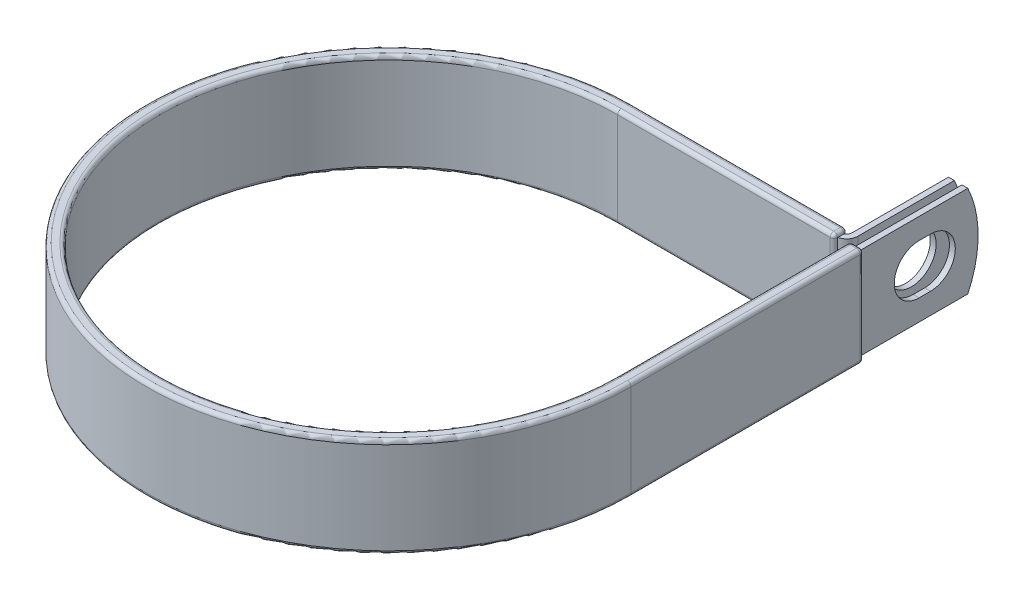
SolidWorks part; units mm, degrees
ref_plane "Front Plane" through (0, 0, 0) normal (0, 0, 1) x (1, 0, 0)
ref_plane "Top Plane" through (0, 0, 0) normal (0, 1, 0) x (1, 0, 0)
ref_plane "Right Plane" through (0, 0, 0) normal (1, 0, 0) x (0, 0, -1)
sketch "Sketch1" plane through (0, 0, 0) normal (0, 1, 0) x (1, 0, 0)
  line L0 (0, 48.4187) -> (44.4665, 48.4187)
  line L1 (48.4187, 0) -> (48.4187, 48.4187)
  line L2 (46.8439, 72.9996) -> (46.8439, 50.7962)
  line L5 (48.4187, 48.4187) -> (48.4187, 72.9996)
  arc A0 (0, 48.4187) -> (48.4187, 0) centre (0, 0) ccw
  arc A3 (44.4665, 48.4187) -> (46.8439, 50.7962) centre (44.4665, 50.7962) ccw
extrude "Extrude-Thin1" add sketch "Sketch1" along normal mid plane 19.05 thin
sketch "Sketch2" plane through (45.6247, 0, 0) normal (-1, 0, 0) x (0, 0, 1)
  line L0 (-72.9996, 9.525) -> (-72.9996, -9.525) construction
  line L7 (0, 9.525) -> (0, -9.525) construction
  circle A0 centre (-61.8998, 0) radius 5.1562
  point P2 (-72.9996, 0)
extrude "Cut-Extrude1" cut sketch "Sketch2" against normal up to surface (1.2192 mm away)
sketch "Sketch3" plane through (49.6379, 0, 0) normal (1, 0, 0) x (0, 0, -1)
  line L0 (60.706, 0) -> (63.0936, 0) construction
  line L1 (60.706, 5.1562) -> (63.0936, 5.1562)
  line L2 (60.706, -5.1562) -> (63.0936, -5.1562)
  line L3 (72.9996, 9.525) -> (72.9996, -9.525) construction
  arc A0 (60.706, 5.1562) -> (60.706, -5.1562) centre (60.706, 0) ccw
  arc A1 (63.0936, -5.1562) -> (63.0936, 5.1562) centre (63.0936, 0) ccw
  point P3 (61.8998, 0)
  point P8 (72.9996, 0)
  point P11 (55.5498, 0)
  point P12 (68.2498, 0)
extrude "Cut-Extrude2" cut sketch "Sketch3" against normal up to surface (1.2192 mm away)
sketch "Sketch4" plane through (45.6247, 0, 0) normal (-1, 0, 0) x (0, 0, 1)
  line L0 (-72.9996, 9.525) -> (-72.9996, -9.525)
  line L1 (-72.9996, 9.525) -> (-70.8551, 9.525)
  line L2 (-72.9996, 9.525) -> (-50.7962, 9.525) construction
  line L3 (-72.9996, -9.525) -> (-70.8551, -9.525)
  line L4 (-72.9996, -9.525) -> (-50.7962, -9.525) construction
  arc A0 (-70.8551, 9.525) -> (-70.8551, -9.525) centre (-50.7746, 0) ccw
extrude "Cut-Extrude3" cut sketch "Sketch4" against normal through all contours A0 M4 M5 | A0 L0 M2
ref_plane "Plane1" through (0, 0, -48.4187) normal (0, 0, 1) x (1, 0, 0)
ref_plane "Plane2" through (0, 0, 0) normal (-1, 0, 0) x (0, 0, 1)
sketch "Sketch5" plane through (0, 0, -48.4187) normal (0, 0, 1) x (1, 0, 0)
  line L0 (48.4187, 9.525) -> (49.6379, 9.525)
  line L1 (48.4187, -9.525) -> (48.4187, 9.525)
  line L2 (47.625, -9.5567) -> (47.625, 9.5567)
  line L3 (49.6379, 9.525) -> (49.6379, -9.525)
  line L4 (49.6379, -9.525) -> (48.4187, -9.525)
  line L5 (48.387, 10.3187) -> (49.6697, 10.3187)
  line L7 (50.4317, 9.5567) -> (50.4317, -9.5567)
  line L8 (49.6697, -10.3187) -> (48.387, -10.3187)
  line L9 (47.625, -10.3187) -> (47.625, 10.3187) construction
  line L11 (50.4317, -10.3187) -> (47.625, -10.3187) construction
  line L12 (50.4317, 10.3187) -> (50.4317, -10.3187) construction
  line L13 (47.625, 10.3187) -> (50.4317, 10.3187) construction
  arc A0 (47.625, -9.5567) -> (48.387, -10.3187) centre (48.387, -9.5567) ccw
  arc A1 (50.4317, -9.5567) -> (49.6697, -10.3187) centre (49.6697, -9.5567) cw
  arc A2 (47.625, 9.5567) -> (48.387, 10.3187) centre (48.387, 9.5567) cw
  arc A3 (49.6697, 10.3187) -> (50.4317, 9.5567) centre (49.6697, 9.5567) cw
sketch "Sketch6" plane through (0, 9.525, 0) normal (0, 1, 0) x (1, 0, 0)
  line L0 (47.625, 0) -> (47.625, 48.4187)
  line L1 (0, 47.625) -> (44.9898, 47.625)
  line L2 (45.6247, 70.8551) -> (45.6247, 50.7962) construction
  arc A0 (0, 47.625) -> (47.625, 0) centre (0, 0) ccw
sweep "Sweep1" add profiles "Sketch5" path "Sketch6"
fillet "Fillet1" radius 0.762 16 edges at (44.9898, 10.0956, -50.2085) (44.9898, 0, -50.4317) (44.9898, -10.0956, -50.2085) (44.9898, -10.3187, -49.0283) (44.9898, -10.0956, -47.8482) (44.9898, 0, -47.625) (44.9898, 10.0956, -47.8482) (50.2085, 10.0956, -48.4187) (50.4317, 0, -48.4187) (50.2085, -10.0956, -48.4187) (49.0283, -10.3187, -48.4187) (47.8482, -10.0956, -48.4187) (47.625, 0, -48.4187) (47.8482, 10.0956, -48.4187) (44.9898, 10.3187, -49.0283) (49.0283, 10.3187, -48.4187)
equation "\"D4@Sketch5\" = \"D1@Extrude-Thin1\""
equation "\"D5@Sketch5\" = \"D5@Extrude-Thin1\""
equation "\"D1@Sketch3\" = \"D2@Sketch2\""
equation "\"D7@Sketch1\" = \"D3@Sketch2\" + \"D1@Sketch3\""
equation "\"D1@Sketch1\" = \"D1@Sketch6\" + 2 * \"D3@Sketch5\""
equation "\"D1@Sketch4\" = ( \"D1@Extrude-Thin1\" + .125 ) * 2"
equation "\"D2@Sketch1\"=1.95*\"D5@Extrude-Thin1\""
equation "\"D2@Sketch3\" = \"D1@Sketch2\""
